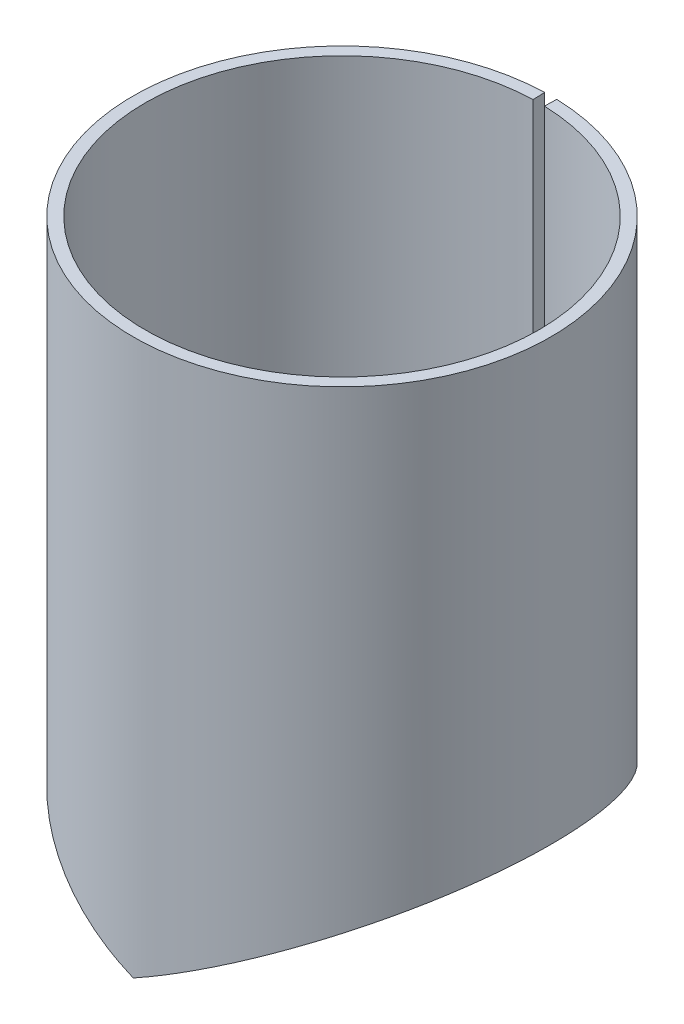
SolidWorks part; units mm, degrees
ref_plane "前视基准面" through (0, 0, 0) normal (0, 0, 1) x (1, 0, 0)
ref_plane "上视基准面" through (0, 0, 0) normal (0, 1, 0) x (1, 0, 0)
ref_plane "右视基准面" through (0, 0, 0) normal (1, 0, 0) x (0, 0, -1)
imported_body "基体零件-任意角度四通管-1"
sheet metal parameters "钣金1" parameters "D1"=0.7366, "厚度"=1
bend "圆角折弯1" bend radius 16.3631 bend angle 356.7 parameters "D5"=1
flatten bends "展开-折弯1"
sketch "尖角-草图1" plane through (-0.5, 23.1888, -17.3559) normal (-0.0288, 0, -0.9996) x (-0.9996, 0, 0.0288)
  line L0 (50.9349, 22.9816) -> (50.9349, -22.9468) construction
  dimension "D1" = 0
process bends "加工-折弯1" parameters "D1"=0
sketch "平面-草图1" plane through (-0.5, 23.1888, -17.3559) normal (-0.0288, 0, -0.9996) x (-0.9996, 0, 0.0288)
